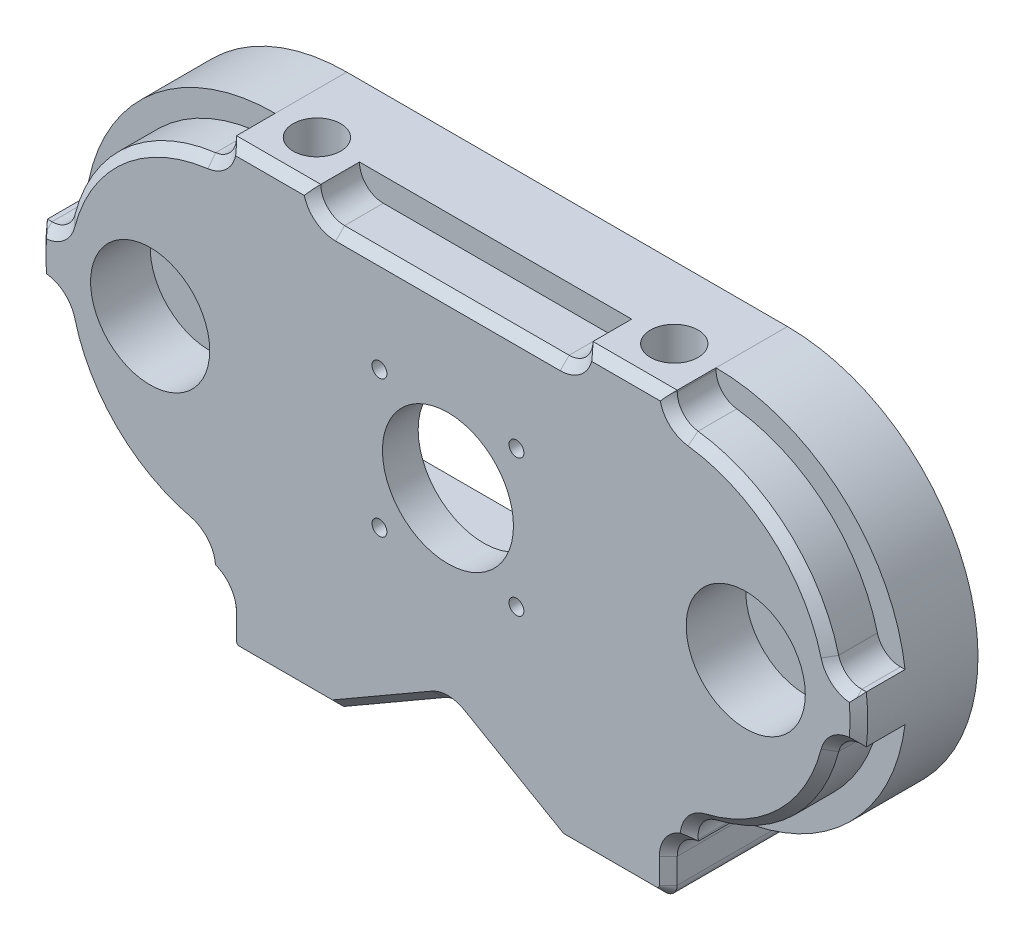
SolidWorks part; units mm, degrees
ref_plane "Front Plane" through (0, 0, 0) normal (0, 0, 1) x (1, 0, 0)
ref_plane "Top Plane" through (0, 0, 0) normal (0, 1, 0) x (1, 0, 0)
ref_plane "Right Plane" through (0, 0, 0) normal (1, 0, 0) x (0, 0, -1)
sketch "Sketch1" plane through (0, 0, 0) normal (0, 0, 1) x (1, 0, 0)
  line L0 (13, 32) -> (87, 32)
  line L1 (0, 0) -> (100, 0) construction
  line L3 (13, -35.7771) -> (13, -40)
  line L4 (15, -42) -> (31, -42)
  line L5 (48, -32.185) -> (31, -42)
  line L6 (50, 0) -> (50, -58.0487) construction
  line L7 (52, -32.185) -> (69, -42)
  line L8 (69, -42) -> (85, -42)
  line L9 (87, -40) -> (87, -35.7771)
  circle A0 centre (0, 0) radius 4
  arc A1 (13, 32) -> (9.4444, -31.8019) centre (13, 0) ccw
  arc A2 (90.5556, -31.8019) -> (87, 32) centre (87, 0) ccw
  circle A3 centre (100, 0) radius 4
  arc A4 (48, -32.185) -> (52, -32.185) centre (50, -35.6491) cw
  arc A5 (87, -35.7771) -> (90.5556, -31.8019) centre (91, -35.7771) cw
  arc A6 (13, -35.7771) -> (9.4444, -31.8019) centre (9, -35.7771) ccw
  arc A7 (85, -42) -> (87, -40) centre (85, -40) ccw
  arc A8 (13, -40) -> (15, -42) centre (15, -40) ccw
  point P21 (50, -31.0303)
  point P23 (87, -32)
  point P26 (13, -32)
  point P29 (87, -42)
  point P32 (13, -42)
  dimension "D1" = 74
  dimension "D2" = 32
  dimension "D5" = 10
  dimension "D3" = 10
  dimension "D8" = 4
  dimension "D9" = 18
  dimension "D10" = 18
  dimension "D11" = 4
  dimension "D12" = 2
  dimension "D13" = 2
  dimension "D4" = 100
  dimension "D6" = 120
  dimension "D7" = 60
extrude "Extrude1" add sketch "Sketch1" along normal blind 20
ref_plane "Plane1" through (0, -42, 0) normal (0, 1, 0) x (-1, 0, 0)
sketch "Sketch8" plane through (0, -42, 0) normal (0, 1, 0) x (-1, 0, 0)
  line L0 (-48, 20) -> (-52, 20) construction
  line L1 (-15, 20) -> (-31, 20) construction
  line L2 (-69, 20) -> (-85, 20) construction
  circle A0 centre (-20, 12) radius 4
  circle A1 centre (-80, 12) radius 4
  point P4 (-50, 20)
  point P13 (-23, 20)
  point P14 (-77, 20)
  dimension "D3" = 8
  dimension "D4" = 8
  dimension "D5" = 8
  dimension "D6" = 8
  dimension "D1" = 60
  dimension "D2" = 30
extrude "Extrude3" cut sketch "Sketch8" along normal blind 100
sketch "Sketch9" plane through (0, 0, 20) normal (0, 0, 1) x (1, 0, 0)
  circle A0 centre (0, 0) radius 10
  circle A1 centre (100, 0) radius 10
  dimension "D1" = 20
  dimension "D2" = 20
extrude "Extrude4" cut sketch "Sketch9" against normal blind 10
sketch "Sketch12" plane through (0, 0, 20) normal (0, 0, 1) x (1, 0, 0)
  line L0 (9.4444, -31.8019) -> (9.4723, -31.5524)
  line L1 (87, 32) -> (13, 32) construction
  line L2 (68.8491, 28) -> (31.1509, 28)
  line L4 (117.9839, 4) -> (118.749, 4)
  line L5 (-17.9839, 4) -> (-18.749, 4)
  line L6 (117.9839, -4) -> (118.749, -4)
  line L7 (-17.9839, -4) -> (-18.749, -4)
  line L8 (72.8491, 32) -> (27.1509, 32)
  line L9 (90.5277, -31.5524) -> (90.5556, -31.8019)
  line L10 (90.5556, -31.8019) -> (90.4647, -31.5578)
  line L11 (13, 32) -> (13, 31.749)
  line L12 (87, 32) -> (87, 31.749)
  line L13 (87, 28) -> (13, 28) construction
  line L15 (87, 32) -> (13, 32) construction
  arc A0 (90.5556, -31.8019) -> (87, 32) centre (87, 0) ccw construction
  arc A1 (13, 32) -> (9.4444, -31.8019) centre (13, 0) ccw construction
  arc A2 (90.5556, -31.8019) -> (118.749, -4) centre (87, 0) ccw
  arc A3 (13, 32) -> (-18.749, 4) centre (13, 0) ccw
  arc A4 (90.5, 27.7804) -> (114.1109, 7) centre (87, 0) cw
  arc A5 (-14.1109, -7) -> (-17.9839, -4) centre (-17.9839, -8) ccw
  arc A6 (13, 28) -> (9.8889, -27.8266) centre (13, 0) ccw construction
  arc A7 (-14.1109, 7) -> (-17.9839, 4) centre (-17.9839, 8) cw
  arc A8 (9.5, 27.7804) -> (-14.1109, 7) centre (13, 0) ccw
  arc A9 (-14.1109, -7) -> (6.435, -27.2195) centre (13, 0) ccw
  arc A10 (13, 28) -> (9.8889, -27.8266) centre (13, 0) ccw construction
  arc A11 (90.1111, -27.8266) -> (87, 28) centre (87, 0) ccw construction
  arc A12 (114.1109, -7) -> (93.565, -27.2195) centre (87, 0) cw
  arc A13 (114.1109, -7) -> (117.9839, -4) centre (117.9839, -8) cw
  arc A14 (114.1109, 7) -> (117.9839, 4) centre (117.9839, 8) ccw
  arc A15 (90.5556, -31.8019) -> (87, 32) centre (87, 0) ccw construction
  arc A16 (9.5, 27.7804) -> (13, 31.749) centre (9, 31.749) ccw
  arc A17 (90.5, 27.7804) -> (87, 31.749) centre (91, 31.749) cw
  arc A18 (27.1509, 32) -> (31.1509, 28) centre (31.1509, 32) ccw
  arc A19 (72.8491, 32) -> (68.8491, 28) centre (68.8491, 32) cw
  arc A20 (6.435, -27.2195) -> (9.4723, -31.5524) centre (5.4971, -31.108) cw
  arc A21 (93.565, -27.2195) -> (90.5277, -31.5524) centre (94.5029, -31.108) ccw
  arc A22 (-18.749, -4) -> (9.4444, -31.8019) centre (13, 0) ccw
  arc A23 (13, 32) -> (9.4444, -31.8019) centre (13, 0) ccw construction
  arc A24 (90.5556, -31.8019) -> (118.749, -4) centre (87, 0) ccw
  arc A25 (118.749, 4) -> (87, 32) centre (87, 0) ccw
  dimension "D4" = 4
  dimension "D5" = 4
  dimension "D6" = 4
  dimension "D2" = 4
  dimension "D1" = 4
extrude "Extrude6" cut sketch "Sketch12" against normal blind 8 contours A20 L0 A22 L7 A5 A9 | A17 L12 A25 L4 A14 A4 | L2 A18 L8 A19 | A8 A7 L5 A3 L11 A16 | A21 A12 A13 L6 A2 L9
sketch "Sketch13" plane through (0, 0, 0) normal (0, 0, -1) x (-1, 0, 0)
  line L0 (-87, 32) -> (-13, 32) construction
  line L2 (-87, 32) -> (-13, 32)
  line L8 (-61.5, -11.5) -> (-38.5, 11.5) construction
  line L9 (-61.5, 11.5) -> (-38.5, -11.5) construction
  circle A0 centre (-50, 0) radius 11
  circle A1 centre (-61.5, 11.5) radius 1.25
  circle A2 centre (-38.5, 11.5) radius 1.25
  circle A3 centre (-38.5, -11.5) radius 1.25
  circle A4 centre (-61.5, -11.5) radius 1.25
  arc A5 (-9.4444, -31.8019) -> (-13, 32) centre (-13, 0) ccw construction
  arc A6 (-87, 32) -> (-90.5556, -31.8019) centre (-87, 0) ccw construction
  arc A7 (-9.4444, -31.8019) -> (-13, 32) centre (-13, 0) ccw
  arc A8 (-87, 32) -> (-90.5556, -31.8019) centre (-87, 0) ccw
  dimension "D1" = 22
  dimension "D4" = 2.5
  dimension "D5" = 2.5
  dimension "D6" = 2.5
  dimension "D7" = 2.5
  dimension "D2" = 23
  dimension "D3" = 23
extrude "Extrude8" cut sketch "Sketch13" against normal blind 119 contours A2 | A1 | A0 | A4 | A3
sketch "Sketch14" plane through (0, 0, 0) normal (0, 0, -1) x (-1, 0, 0)
  line L0 (-87, 32) -> (-13, 32) construction
  line L1 (-87, 32) -> (-13, 32)
  line L2 (-90.5556, -31.8019) -> (-9.4444, -31.8019)
  line L3 (-90.3252, -27.8019) -> (-9.6748, -27.8019)
  line L4 (-87, 28) -> (-13, 28)
  line L12 (-89.946, -21.8019) -> (-10.054, -21.8019)
  line L13 (-87, 22) -> (-13, 22)
  arc A0 (-9.4444, -31.8019) -> (-13, 32) centre (-13, 0) ccw construction
  arc A1 (-87, 32) -> (-90.5556, -31.8019) centre (-87, 0) ccw construction
  arc A2 (-9.4444, -31.8019) -> (-13, 32) centre (-13, 0) ccw
  arc A3 (-87, 32) -> (-90.5556, -31.8019) centre (-87, 0) ccw
  arc A4 (-87, 28) -> (-90.3252, -27.8019) centre (-87, 0) ccw
  arc A5 (-9.6748, -27.8019) -> (-13, 28) centre (-13, 0) ccw
  arc A13 (-87, 22) -> (-89.946, -21.8019) centre (-87, 0) ccw
  arc A14 (-10.054, -21.8019) -> (-13, 22) centre (-13, 0) ccw
  dimension "D2" = 22
  dimension "D1" = 74
extrude "Extrude9" cut sketch "Sketch14" against normal blind 7 contours L13 A14 L12 A13 | L4 A5 L3 A4
sketch "Sketch15" plane through (0, 0, 0) normal (0, 0, -1) x (-1, 0, 0)
  line L1 (-26, -18) -> (-74, -18)
  line L2 (-26, -18) -> (-26, 18)
  line L3 (-26, 18) -> (-74, 18)
  line L4 (-74, -18) -> (-74, 18)
  line L5 (-26, -18) -> (-74, 18) construction
  line L6 (-26, 18) -> (-74, -18) construction
  point P0 (-50, 0)
  dimension "D1" = 36
  dimension "D2" = 48
extrude "Extrude10" cut sketch "Sketch15" against normal blind 14
sketch "Sketch16" plane through (0, 0, 0) normal (0, 0, -1) x (-1, 0, 0)
  line L1 (-26, -18) -> (-26, 18) construction
  line L2 (-74, 18) -> (-74, -18) construction
  line L3 (-74, 18) -> (-74, -18)
  line L4 (-26, -18) -> (-26, 18)
  arc A0 (-74, 18) -> (-74, -18) centre (-74, 0) ccw
  arc A1 (-26, -18) -> (-26, 18) centre (-26, 0) ccw
extrude "Extrude12" cut sketch "Sketch16" against normal blind 6
chamfer "Chamfer1" distance 1.5 angle 45 3 edges at (-14.9504, 1.6655, 0) (50, 28, 0) (114.9504, 1.6655, 0)
chamfer "Chamfer2" distance 1.5 angle 45 1 edges at (50, -27.8019, 0)
chamfer "Chamfer3" distance 1.5 angle 45 30 edges at (-19, 0, 20) (-15.5344, 4.8377, 20) (-5.499, 21.0187, 20) (12, 29.1033, 20) (20.0755, 32, 20) (28.3225, 29.1716, 20) (50, 28, 20) (71.6775, 29.1716, 20) (79.9245, 32, 20) (88, 29.1033, 20) (105.499, 21.0187, 20) (115.5344, 4.8377, 20) (119, 0, 20) (115.5344, -4.8377, 20) (91.2275, -28.8119, 20) (106.6399, -19.9569, 20) (88.0186, -33.1104, 20) (87, -37.8885, 20) (86.4142, -41.4142, 20) (77, -42, 20) (60.5, -37.0925, 20) (50, -31.6491, 20) (39.5, -37.0925, 20) (23, -42, 20) (13.5858, -41.4142, 20) (13, -37.8885, 20) (11.9814, -33.1104, 20) (-15.5344, -4.8377, 20) (8.7725, -28.8119, 20) (-6.6399, -19.9569, 20)
